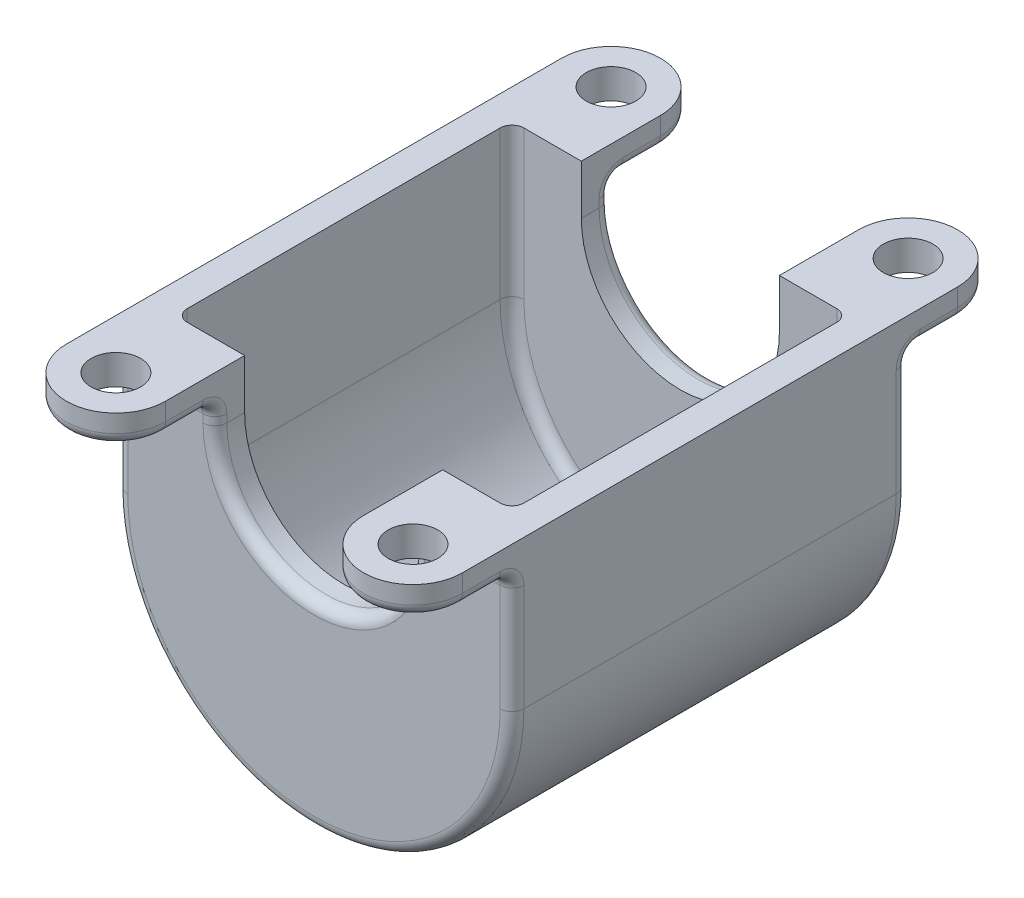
SolidWorks part; units mm, degrees
ref_plane "Front" through (0, 0, 0) normal (0, 0, 1) x (1, 0, 0)
ref_plane "Top" through (0, 0, 0) normal (0, 1, 0) x (1, 0, 0)
ref_plane "Right" through (0, 0, 0) normal (1, 0, 0) x (0, 0, -1)
sketch "Sketch1" plane through (0, 0, 0) normal (0, 0, 1) x (1, 0, 0)
  line L0 (0, 7.7753) -> (0, 95.1117) construction
  line L1 (50.8, 0) -> (25.4, 0)
  line L2 (-50.8, 0) -> (-50.8, -38.1)
  line L3 (50.8, 0) -> (50.8, -38.1)
  line L4 (-25.4, 0) -> (-25.4, -12.7)
  line L5 (25.4, 0) -> (25.4, -12.7)
  line L6 (-25.4, 0) -> (-50.8, 0)
  arc A0 (-50.8, -38.1) -> (50.8, -38.1) centre (0, -38.1) ccw
  arc A1 (-25.4, -12.7) -> (25.4, -12.7) centre (0, -12.7) ccw
  dimension "D1" = 50.8
  dimension "D2" = 25.4
  dimension "D3" = 38.1
extrude "Base-Extrude" add sketch "Sketch1" along normal blind 50.8
shell "Shell1" thickness 7.62
sketch "Sketch2" plane through (0, 0, 0) normal (0, 1, 0) x (-1, 0, 0)
  line L0 (25.4, 43.18) -> (50.8, 43.18)
  line L1 (25.4, 43.18) -> (25.4, 63.5)
  line L3 (50.8, 63.5) -> (50.8, 43.18)
  line L4 (50.8, 50.8) -> (50.8, 0) construction
  arc A0 (50.8, 63.5) -> (25.4, 63.5) centre (38.1, 63.5) ccw
  circle A1 centre (38.1, 63.5) radius 6.35
  dimension "D2" = 12.7
  dimension "D1" = 20.32
extrude "Boss-Extrude1" add sketch "Sketch2" against normal blind 7.62
mirror "Mirror1" about plane through (0, 0, 0) normal (1, 0, 0) of "Boss-Extrude1"
mirror "Boss-Mirror1"
fillet "Fillet1" radius 3.048 10 edges at (43.18, -19.05, 43.18) (-43.18, -19.05, 43.18) (0, -81.28, 43.18) (-38.1, -7.62, 50.8) (38.1, -7.62, 50.8) (43.18, -19.05, -43.18) (-43.18, -19.05, -43.18) (0, -81.28, -43.18) (-38.1, -7.62, -50.8) (38.1, -7.62, -50.8)
fillet "Fillet2" radius 3.048 32 edges at (0, -88.9, 50.8) (50.8, -24.384, 50.8) (25.4, -11.684, 50.8) (-25.4, -11.684, 50.8) (-50.8, -24.384, 50.8) (25.4, -7.62, 58.674) (-25.4, -7.62, 58.674) (25.4, -7.62, -58.674) (50.8, -24.384, -50.8) (-50.8, -24.384, -50.8) (-25.4, -11.684, -50.8) (25.4, -11.684, -50.8) (-25.4, -7.62, -58.674) (25.4, -8.5127, 51.6927) (50.8, -8.5127, 51.6927) (-50.8, -8.5127, 51.6927) (-25.4, -8.5127, 51.6927) (25.4, -8.5127, -51.6927) (50.8, -8.5127, -51.6927) (-50.8, -8.5127, -51.6927) (-25.4, -8.5127, -51.6927) (0, -38.1, 50.8) (-38.1, -7.62, 76.2) (-50.8, -7.62, 58.674) (38.1, -7.62, 76.2) (50.8, -7.62, 58.674) (0, -38.1, -50.8) (-50.8, -7.62, -58.674) (0, -88.9, -50.8) (-38.1, -7.62, -76.2) (50.8, -7.62, -58.674) (38.1, -7.62, -76.2)
